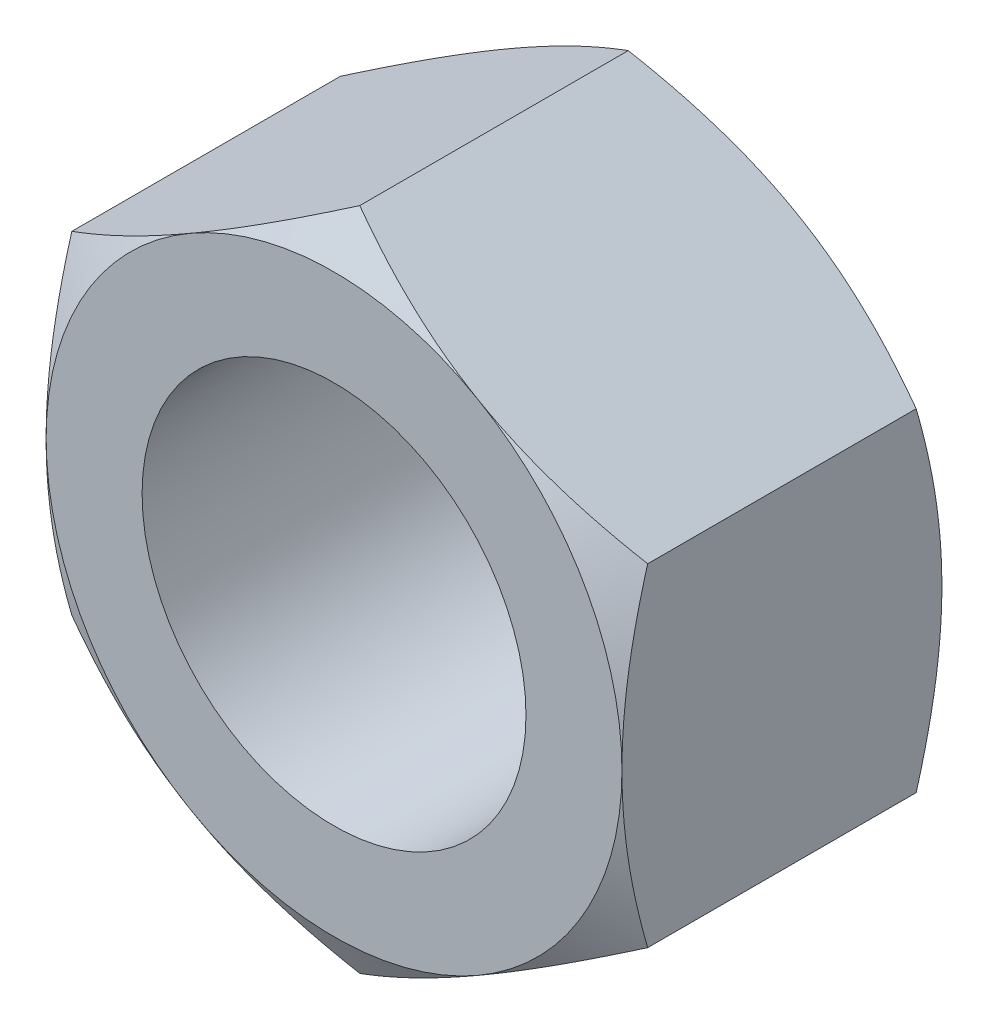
SolidWorks part; units mm, degrees
ref_plane "Plan de face" through (0, 0, 0) normal (0, 0, 1) x (1, 0, 0)
ref_plane "Plan de dessus" through (0, 0, 0) normal (0, 1, 0) x (1, 0, 0)
ref_plane "Plan de droite" through (0, 0, 0) normal (1, 0, 0) x (0, 0, -1)
mirrored part "Ecrou H M12 din 934_Rendre symétrique"
other "<Ecrou H M12 din 934>-<Enlèv. mat.-Extru.1>"
